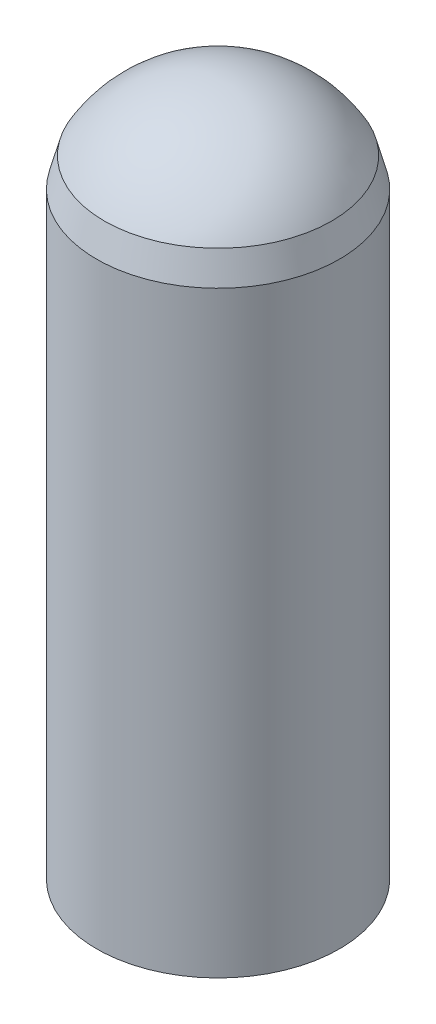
SolidWorks part; units mm, degrees
ref_plane "Vorne" through (0, 0, 0) normal (0, 0, 1) x (1, 0, 0)
ref_plane "Oben" through (0, 0, 0) normal (0, 1, 0) x (1, 0, 0)
ref_plane "Rechts" through (0, 0, 0) normal (1, 0, 0) x (0, 0, -1)
sketch "Skizze1" plane through (0, 0, 0) normal (0, 0, 1) x (1, 0, 0)
  line L0 (0, 0) -> (0, 6) construction
  line L1 (0, 6) -> (0, 0)
  line L2 (1, 0.3) -> (1, 5.22)
  line L3 (1, 5.22) -> (0.9357, 5.46)
  line L4 (0, 0) -> (0.1, 0)
  arc A0 (0.1, 0) -> (1, 0.3) centre (0.1, 1.5) ccw
  arc A1 (0.9357, 5.46) -> (0, 6) centre (0, 4.9193) ccw
  dimension "D1" = 0.24
  dimension "d" = 2
  dimension "D2" = 0.2
  dimension "z" = 0.3
  dimension "a" = 0.78
  dimension "Länge" = 6
  dimension "D6" = 15
revolve "Rotation1" add sketch "Skizze1" angle 360 about L0
